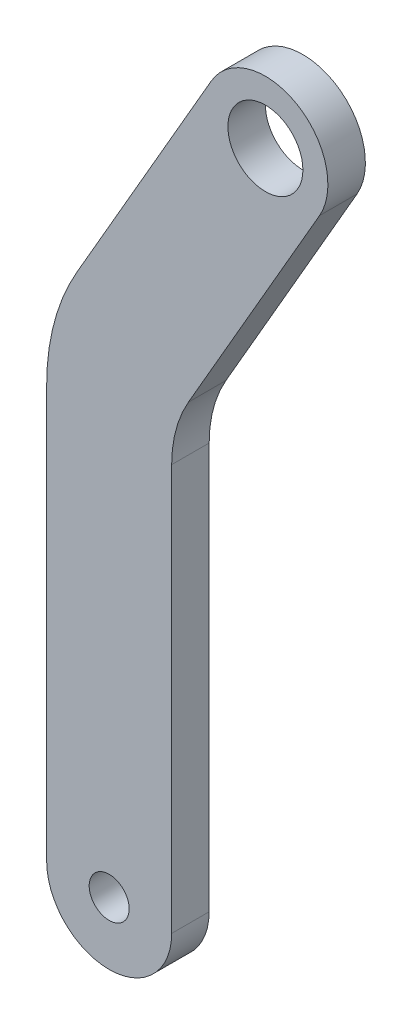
SolidWorks part; units mm, degrees
ref_plane "Plan de face" through (0, 0, 0) normal (0, 0, 1) x (1, 0, 0)
ref_plane "Plan de dessus" through (0, 0, 0) normal (0, 1, 0) x (1, 0, 0)
ref_plane "Plan de droite" through (0, 0, 0) normal (1, 0, 0) x (0, 0, -1)
sketch "Esquisse1" plane through (0, 0, 0) normal (0, 0, 1) x (1, 0, 0)
  line L0 (0, -61.7286) -> (0, 57.9712) construction
  line L1 (-14.4928, 0) -> (43.4784, 0) construction
  line L2 (0, 0) -> (12.5, 21.6506) construction
  line L3 (43.4784, -36.5) -> (-14.4928, -36.5) construction
  line L4 (1.0864, 28.2403) -> (30.7341, 11.1231) construction
  line L5 (0, 0) -> (-28.8932, 16.6815) construction
  line L6 (-5, -36.5) -> (-5, -3.4833)
  line L7 (5, -36.5) -> (5, -4.0192)
  line L8 (8.1699, 24.1506) -> (-2.5885, 5.5167)
  line L9 (16.8301, 19.1506) -> (6.3397, 0.9808)
  circle A0 centre (0, -36.5) radius 1.6
  arc A1 (-5, -36.5) -> (5, -36.5) centre (0, -36.5) ccw
  arc A2 (16.8301, 19.1506) -> (8.1699, 24.1506) centre (12.5, 21.6506) ccw
  circle A3 centre (12.5, 21.6506) radius 3
  arc A4 (5, -4.0192) -> (6.3397, 0.9808) centre (15, -4.0192) cw
  arc A5 (-2.5885, 5.5167) -> (-5, -3.4833) centre (13, -3.4833) ccw
  dimension "D4" = 10
  dimension "D5" = 18
  dimension "D1" = 30
  dimension "D2" = 90
  dimension "D3" = 36.5
extrude "Boss.-Extru.1" add sketch "Esquisse1" along normal blind 3
